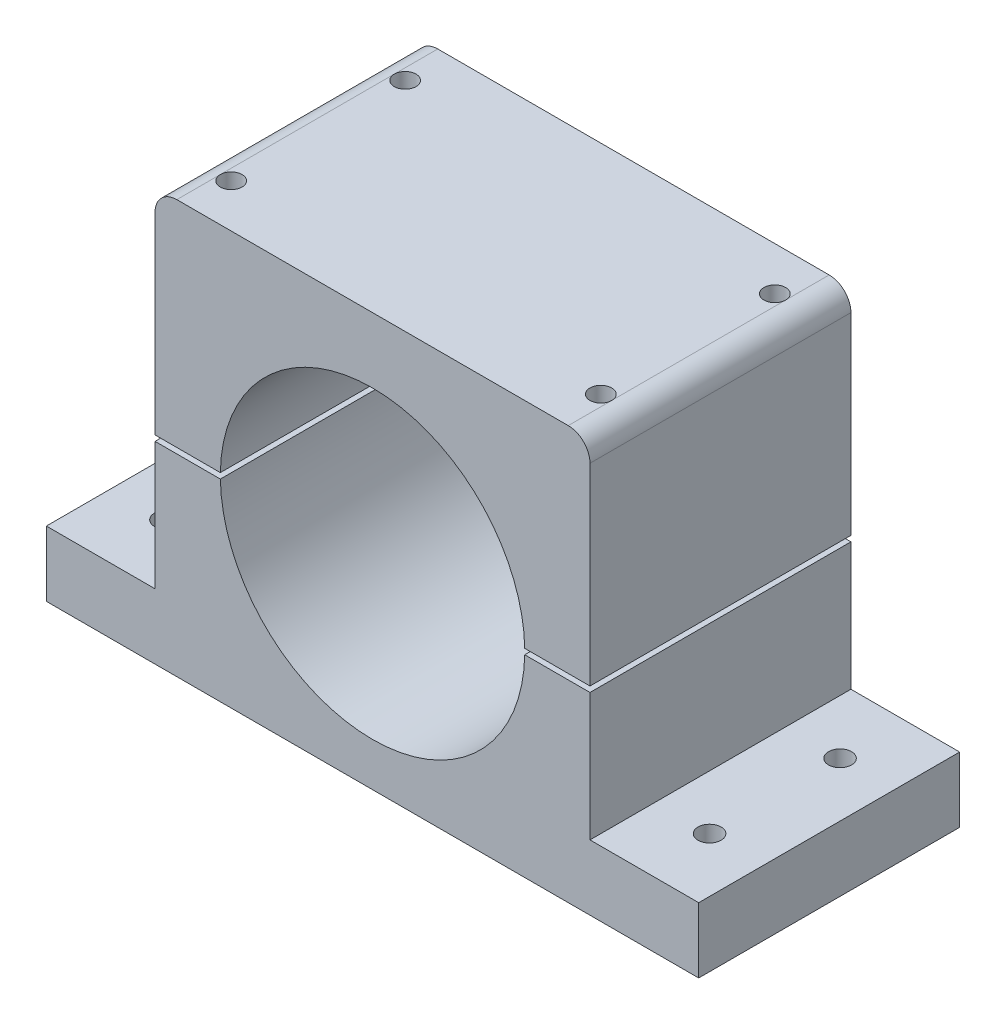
SolidWorks part; units mm, degrees
ref_plane "Front Plane" through (0, 0, 0) normal (0, 0, 1) x (1, 0, 0)
ref_plane "Top Plane" through (0, 0, 0) normal (0, 1, 0) x (1, 0, 0)
ref_plane "Right Plane" through (0, 0, 0) normal (1, 0, 0) x (0, 0, -1)
sketch "Sketch1" plane through (0, 0, 0) normal (0, 0, 1) x (1, 0, 0)
  line L1 (-95.25, -57.15) -> (95.25, -57.15)
  line L2 (-95.25, -57.15) -> (-95.25, 63.5)
  line L3 (-95.25, 63.5) -> (95.25, 63.5)
  line L4 (95.25, -57.15) -> (95.25, 63.5)
  dimension "D1" = 63.5
  dimension "D2" = 120.65
  dimension "D3" = 190.5
  dimension "D4" = 95.25
extrude "Boss-Extrude1" add sketch "Sketch1" against normal blind 76.2
sketch "Sketch2" plane through (0, 0, 0) normal (0, 0, 1) x (1, 0, 0)
  circle A0 centre (0, 0) radius 44.45
  dimension "D1" = 88.9
extrude "Cut-Extrude1" cut sketch "Sketch2" against normal through all
sketch "Sketch3" plane through (0, 0, 0) normal (0, 0, 1) x (1, 0, 0)
  line L0 (-95.25, -57.15) -> (95.25, -57.15) construction
  line L1 (-95.25, 63.5) -> (-63.5, 63.5)
  line L2 (-95.25, 63.5) -> (-95.25, -38.1)
  line L3 (-95.25, -38.1) -> (-63.5, -38.1)
  line L4 (-63.5, 63.5) -> (-63.5, -38.1)
  line L5 (95.25, 63.5) -> (63.5, 63.5)
  line L6 (95.25, 63.5) -> (95.25, -38.1)
  line L7 (95.25, -38.1) -> (63.5, -38.1)
  line L8 (63.5, 63.5) -> (63.5, -38.1)
  dimension "D1" = 19.05
  dimension "D2" = 19.05
  dimension "D3" = 31.75
  dimension "D4" = 31.75
extrude "Cut-Extrude2" cut sketch "Sketch3" against normal through all
sketch "Sketch4" plane through (0, 63.5, 0) normal (0, 1, 0) x (1, 0, 0)
  line L0 (63.5, 76.2) -> (-63.5, 76.2) construction
  line L1 (63.5, 0) -> (-63.5, 0) construction
  circle A0 centre (-53.975, 63.5) radius 3.175
  circle A1 centre (-53.975, 12.7) radius 3.175
  circle A2 centre (53.975, 63.5) radius 3.175
  circle A3 centre (53.975, 12.7) radius 3.175
  dimension "D9" = 6.35
  dimension "D10" = 6.35
  dimension "D11" = 6.35
  dimension "D12" = 6.35
  dimension "D1" = 53.975
  dimension "D2" = 53.975
  dimension "D3" = 53.975
  dimension "D4" = 53.975
  dimension "D5" = 12.7
  dimension "D6" = 12.7
  dimension "D7" = 12.7
  dimension "D8" = 12.7
extrude "Cut-Extrude3" cut sketch "Sketch4" against normal blind 76.2
sketch "Sketch5" plane through (0, -38.1, 0) normal (0, 1, 0) x (1, 0, 0)
  line L0 (-95.25, 76.2) -> (-95.25, 0) construction
  line L1 (-95.25, 76.2) -> (-63.5, 76.2) construction
  line L2 (95.25, 76.2) -> (95.25, 0) construction
  line L3 (63.5, 76.2) -> (95.25, 76.2) construction
  circle A0 centre (-79.375, 57.15) radius 3.3655
  circle A1 centre (-79.375, 19.05) radius 3.3655
  circle A2 centre (79.375, 57.15) radius 3.3655
  circle A3 centre (79.375, 19.05) radius 3.3655
  dimension "D5" = 6.731
  dimension "D6" = 6.731
  dimension "D11" = 6.731
  dimension "D12" = 6.731
  dimension "D1" = 15.875
  dimension "D2" = 19.05
  dimension "D3" = 15.875
  dimension "D4" = 19.05
  dimension "D7" = 38.1
  dimension "D8" = 38.1
  dimension "D9" = 15.875
  dimension "D10" = 15.875
extrude "Cut-Extrude4" cut sketch "Sketch5" against normal through all
fillet "Fillet1" radius 6.35 2 edges at (63.5, 63.5, -38.1) (-63.5, 63.5, -38.1)
sketch "Sketch6" plane through (0, 0, 0) normal (0, 0, 1) x (1, 0, 0)
  line L0 (-63.5, -38.1) -> (-63.5, 57.15) construction
  line L1 (-63.5, -0.8128) -> (63.5, -0.8128)
  line L2 (-63.5, -0.8128) -> (-63.5, 0.8128)
  line L3 (-63.5, 0.8128) -> (63.5, 0.8128)
  line L4 (63.5, -0.8128) -> (63.5, 0.8128)
  line L5 (63.5, 57.15) -> (63.5, -38.1) construction
  dimension "D1" = 0.8128
  dimension "D2" = 0.8128
extrude "Cut-Extrude6" cut sketch "Sketch6" against normal through all
